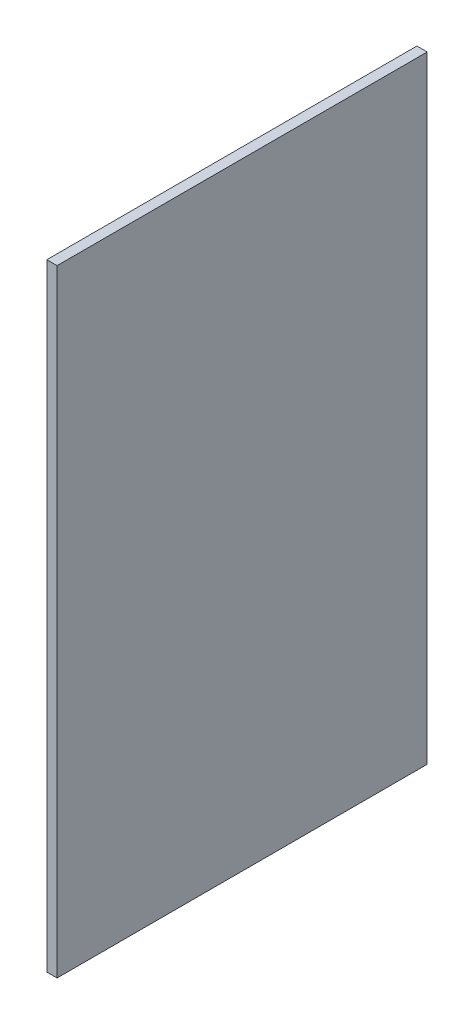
SolidWorks part; units mm, degrees
ref_plane "Plan de face" through (0, 0, 0) normal (0, 0, 1) x (1, 0, 0)
ref_plane "Plan de dessus" through (0, 0, 0) normal (0, 1, 0) x (1, 0, 0)
ref_plane "Plan de droite" through (0, 0, 0) normal (1, 0, 0) x (0, 0, -1)
sketch "Esquisse1" plane through (0, 0, 0) normal (0, 0, 1) x (1, 0, 0)
  line L1 (-50.5375, 299.7316) -> (-44.5375, 299.7316)
  line L2 (-50.5375, 299.7316) -> (-50.5375, -60.2684)
  line L3 (-50.5375, -60.2684) -> (-44.5375, -60.2684)
  line L4 (-44.5375, 299.7316) -> (-44.5375, -60.2684)
  dimension "D1" = 6
  dimension "D2" = 360
extrude "Extrusion1" add sketch "Esquisse1" along normal blind 216
